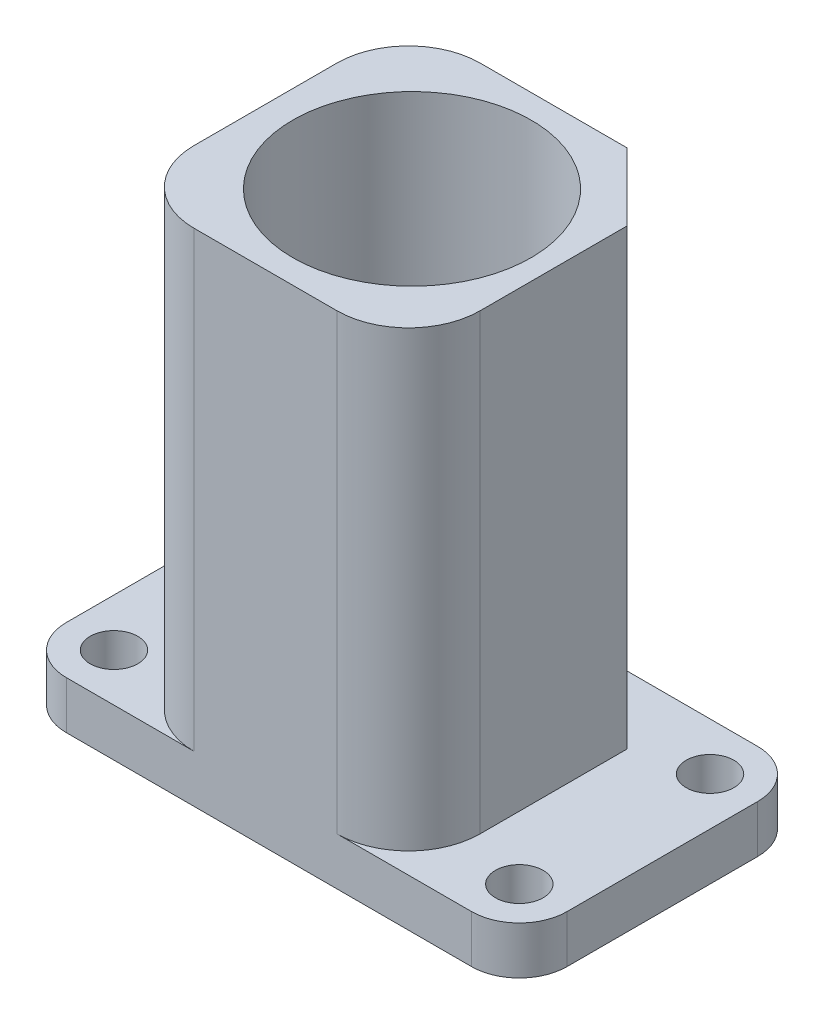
SolidWorks part; units mm, degrees
ref_plane "Front Plane" through (0, 0, 0) normal (0, 0, 1) x (1, 0, 0)
ref_plane "Top Plane" through (0, 0, 0) normal (0, 1, 0) x (1, 0, 0)
ref_plane "Right Plane" through (0, 0, 0) normal (1, 0, 0) x (0, 0, -1)
sketch "Sketch1" plane through (0, 0, 0) normal (0, 1, 0) x (1, 0, 0)
  line L1 (4.25, 3) -> (-4.25, 3)
  line L2 (4.25, 3) -> (4.25, -3)
  line L3 (4.25, -3) -> (-4.25, -3)
  line L4 (-4.25, 3) -> (-4.25, -3)
  line L5 (4.25, 3) -> (-4.25, -3) construction
  line L6 (4.25, -3) -> (-4.25, 3) construction
  point P0 (0, 0)
  dimension "D1" = 6
  dimension "D2" = 8.5
extrude "Boss-Extrude1" add sketch "Sketch1" along normal blind 1
sketch "Sketch2" plane through (0, 1, 0) normal (0, 1, 0) x (1, 0, 0)
  line L0 (1.5132, 3) -> (2.9274, 1.5858)
  line L1 (1.5132, 3) -> (-3.0726, 3)
  line L2 (2.9274, 1.5858) -> (2.9274, -3)
  line L3 (2.9274, -3) -> (-3.0726, -3)
  line L4 (-3.0726, 3) -> (-3.0726, -3)
  line L5 (2.9274, 3.3301) -> (-3.0726, -3) construction
  line L6 (2.9274, -3) -> (-3.0726, 3) construction
  dimension "D1" = 45
  dimension "D2" = 6
  dimension "D3" = 2
extrude "Boss-Extrude2" add sketch "Sketch2" along normal blind 9.5
sketch "Sketch3" plane through (0, 10.5, 0) normal (0, 1, 0) x (1, 0, 0)
  circle A0 centre (0, 0) radius 2.5
  dimension "D1" = 5
extrude "Cut-Extrude1" cut sketch "Sketch3" against normal offset from surface (8.5 mm away) 2
sketch "Sketch7" plane through (-4.25, 0, 0) normal (-1, 0, 0) x (0, 0, 1)
  line L0 (3, 1) -> (3, 0) construction
  line L1 (-3, 1) -> (3, 1)
  line L2 (-3, 1) -> (-3, 0)
  line L3 (-3, 0) -> (3, 0)
  line L4 (3, 1) -> (3, 0)
extrude "Boss-Extrude3" add sketch "Sketch7" along normal blind 1
sketch "Sketch13" plane through (4.25, 0, 0) normal (1, 0, 0) x (0, 0, -1)
  line L1 (3, 1) -> (-3, 1)
  line L2 (3, 1) -> (3, 0)
  line L3 (3, 0) -> (-3, 0)
  line L4 (-3, 1) -> (-3, 0)
extrude "Boss-Extrude4" add sketch "Sketch13" along normal blind 1
sketch "Sketch8" plane through (0, 1, 0) normal (0, 1, 0) x (1, 0, 0)
  line L0 (-4.25, 3) -> (-4.25, 2) construction
  line L1 (-3.0726, 3) -> (-5.25, 3) construction
  line L2 (-4.25, 2) -> (-4.25, -2) construction
  line L3 (-4.25, -2) -> (-4.25, -3) construction
  line L4 (-5.25, -3) -> (-3.0726, -3) construction
  line L5 (-5.25, -3) -> (-5.25, 3) construction
  line L6 (5.25, 3) -> (1.5132, 3) construction
  line L7 (5.25, 3) -> (5.25, -3) construction
  line L8 (4.25, 2) -> (4.25, -2) construction
  line L9 (4.25, -2) -> (-4.25, -2) construction
  circle A0 centre (-4.25, 2) radius 0.5
  circle A1 centre (-4.25, -2) radius 0.5
  circle A2 centre (4.25, 2) radius 0.5
  circle A3 centre (4.25, -2) radius 0.5
  dimension "D2" = 1
  dimension "D4" = 1
  dimension "D1" = 1
  dimension "D3" = 1
  dimension "D5" = 1
extrude "Cut-Extrude2" cut sketch "Sketch8" against normal through all
sketch "Sketch10" plane through (0, 0, 0) normal (0, -1, 0) x (1, 0, 0)
  line L1 (2, 2) -> (-2, 2)
  line L2 (2, 2) -> (2, -2)
  line L3 (2, -2) -> (-2, -2)
  line L4 (-2, 2) -> (-2, -2)
  line L5 (2, 2) -> (-2, -2) construction
  line L6 (2, -2) -> (-2, 2) construction
  point P0 (0, 0)
  dimension "D1" = 4
  dimension "D2" = 4
extrude "Cut-Extrude3" cut sketch "Sketch10" against normal blind 1.3
sketch "Sketch11" plane through (0, 1.3, 0) normal (0, -1, 0) x (1, 0, 0)
  circle A0 centre (0, 0) radius 1.75
  circle A2 centre (0, 0) radius 2.5 construction
  dimension "D1" = 3.5
extrude "Cut-Extrude4" cut sketch "Sketch11" against normal through all
sketch "Sketch12" plane through (0, 0, 0) normal (0, -1, 0) x (1, 0, 0)
  line L0 (2, 2) -> (-2, 2) construction
  line L1 (-2, 2) -> (-2, -2) construction
  line L2 (2, -2) -> (2, 2) construction
  line L3 (-2, -2) -> (2, -2) construction
  circle A0 centre (-1.5, 2) radius 0.5
  circle A1 centre (-2, -1.5) radius 0.5
  circle A2 centre (1.5, -2) radius 0.5
  circle A3 centre (2, 1.5) radius 0.5
  dimension "D1" = 1
extrude "Cut-Extrude5" cut sketch "Sketch12" against normal up to surface (1.3 mm away)
fillet "Fillet1" radius 1 4 edges at (-5.25, 0.5, 3) (-5.25, 0.5, -3) (5.25, 0.5, 3) (5.25, 0.5, -3)
fillet "Fillet2" radius 1.5 3 edges
